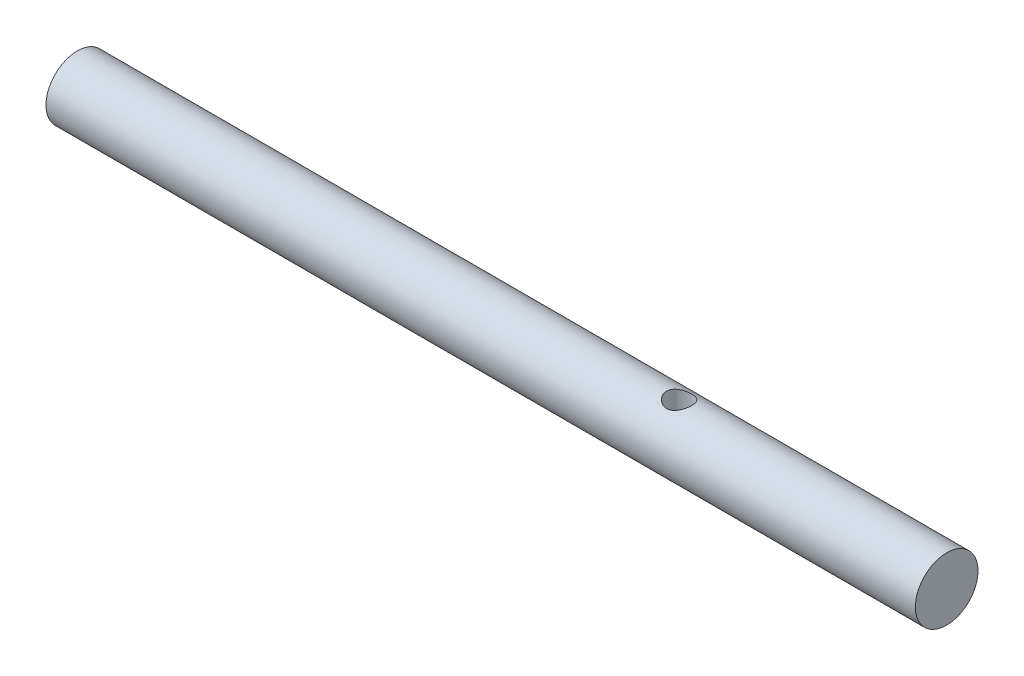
SolidWorks part; units mm, degrees
ref_plane "Front Plane" through (0, 0, 0) normal (0, 0, 1) x (1, 0, 0)
ref_plane "Top Plane" through (0, 0, 0) normal (0, 1, 0) x (1, 0, 0)
ref_plane "Right Plane" through (0, 0, 0) normal (1, 0, 0) x (0, 0, -1)
sketch "Sketch2" plane through (0, 0, 0) normal (0, 0, 1) x (1, 0, 0)
  line L1 (0, 0) -> (-660.4, 0)
  line L2 (0, 0) -> (0, -47.625)
  line L3 (0, -47.625) -> (-660.4, -47.625)
  line L4 (-660.4, 0) -> (-660.4, -47.625)
  dimension "D1" = 660.4
  dimension "D2" = 47.625
extrude "Extrude1" add sketch "Sketch2" along normal blind 47.625
sketch "Sketch3" plane through (0, 0, 0) normal (0, 1, 0) x (1, 0, 0)
  line L0 (0, -47.625) -> (0, 0) construction
  line L1 (0, -47.625) -> (-660.4, -47.625) construction
  circle A0 centre (-203.2, -23.8125) radius 9.525
  dimension "D1" = 19.05
  dimension "D2" = 203.2
  dimension "D3" = 23.8125
extrude "Cut-Extrude1" cut sketch "Sketch3" against normal blind 47.625
sketch "Sketch4" plane through (0, 0, 0) normal (1, 0, 0) x (0, 0, -1)
  line L0 (0, -47.625) -> (0, 0) construction
  line L1 (-47.625, 0) -> (0, 0) construction
  circle A0 centre (-23.8125, -23.8125) radius 23.8125
  dimension "D1" = 47.625
  dimension "D2" = 23.8125
  dimension "D3" = 23.8125
extrude "Cut-Extrude2" cut sketch "Sketch4" against normal blind 660.4 flip side to cut
